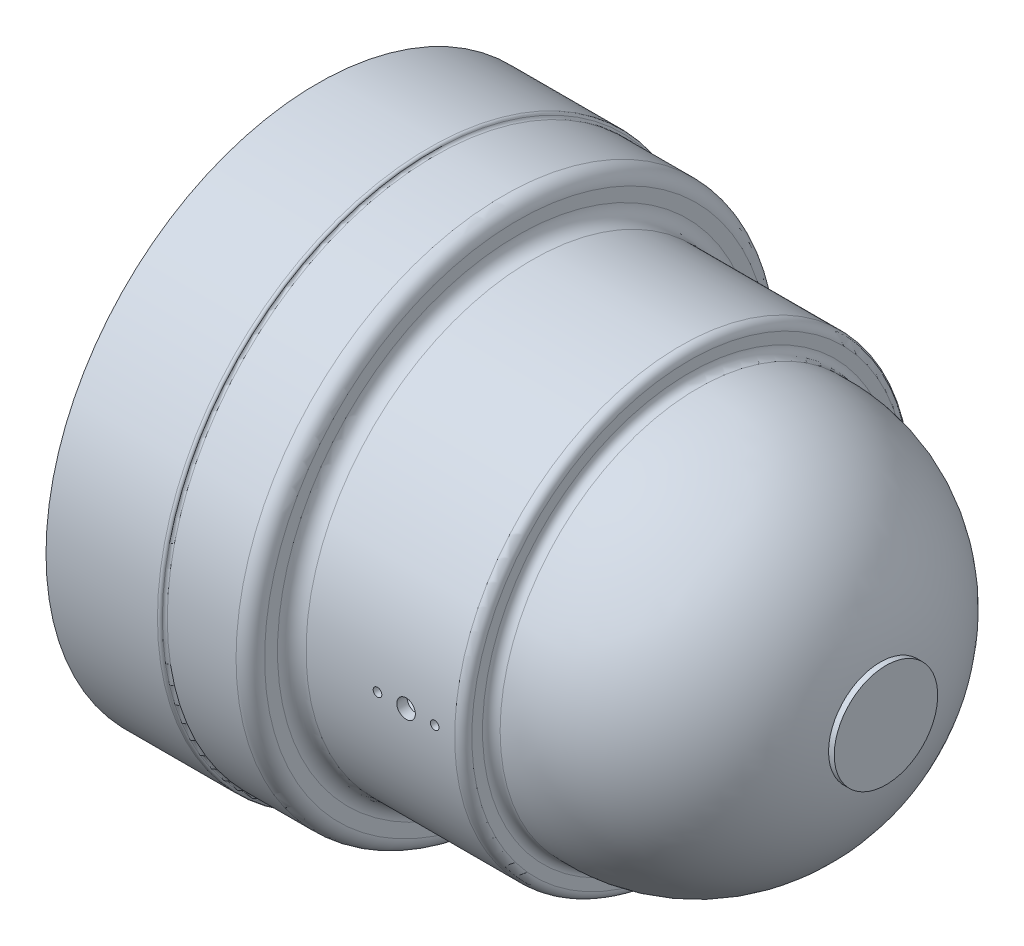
SolidWorks part; units mm, degrees
ref_plane "Plan de face" through (0, 0, 0) normal (0, 0, 1) x (1, 0, 0)
ref_plane "Plan de dessus" through (0, 0, 0) normal (0, 1, 0) x (1, 0, 0)
ref_plane "Plan de droite" through (0, 0, 0) normal (1, 0, 0) x (0, 0, -1)
sketch "Esquisse1" plane through (0, 0, 0) normal (0, 0, 1) x (1, 0, 0)
  line L0 (-213.0143, 0) -> (196.9793, 0) construction
  line L1 (-90, 93.5) -> (-90, 95)
  line L2 (0, 0) -> (-130, 0)
  line L4 (-130, 95) -> (-90, 95)
  line L5 (-130, 0) -> (-130, 95)
  line L6 (-60, 0) -> (-90, 0)
  line L7 (-60, 93.5) -> (-60, 79)
  line L8 (-60, 93.5) -> (-90, 93.5)
  line L9 (-90, 95) -> (-90, 0) construction
  line L10 (-60, 79) -> (0, 79)
  line L11 (0, 0) -> (66.93, 0)
  line L12 (-60, 0) -> (0, 0)
  line L13 (0, 79) -> (0, 0)
  line L14 (0, 0) -> (0, 18.1)
  line L15 (0, 18.1) -> (66.93, 18.1)
  line L16 (66.93, 0) -> (66.93, 18.1)
  line L17 (66.93, 18.1) -> (68.93, 18.1)
  line L18 (66.93, 18.1) -> (66.93, 0)
  line L19 (66.93, 0) -> (68.93, 0)
  line L20 (68.93, 18.1) -> (68.93, 0)
  arc A0 (0, 69) -> (66.93, 18.1) centre (6.4974, 8.0894) cw
  point P5 (0, 69)
  dimension "D12" = 2
  dimension "D11" = 61.2561
  dimension "D1" = 130
  dimension "D2" = 95
  dimension "D3" = 40
  dimension "D4" = 30
  dimension "D5" = 93.5
  dimension "D6" = 79
  dimension "D7" = 60
  dimension "D8" = 10
  dimension "D9" = 66.93
  dimension "D10" = 18.1
revolve "Révolution1" add sketch "Esquisse1" angle 360 about L0
shell "Coque1" thickness 3.6
fillet "Congé1" radius 1 1 edges at (-90, 0, 95)
fillet "Congé2" radius 1 1 edges at (-90, 0, 93.5)
fillet "Congé3" radius 5 1 edges at (-60, 0, 93.5)
fillet "Congé4" radius 5 1 edges at (-60, 0, 79)
fillet "Congé6" radius 3 2 edges at (0, 0, 79) (0, 0, 69)
sketch "Esquisse2" plane through (0, 0, 0) normal (0, 0, 1) x (1, 0, 0)
  line L0 (-130, 95) -> (-130, -95) construction
  line L1 (-130, 0) -> (0, 0) construction
  line L2 (-20, 0) -> (-130, 0) construction
  line L3 (-20, 20.4537) -> (-20, -28.489) construction
  circle A0 centre (-20, 0) radius 3.25
  circle A1 centre (-30, 0) radius 1.5
  circle A2 centre (-10, 0) radius 1.5
  dimension "D2" = 6.5
  dimension "D4" = 3
  dimension "D1" = 110
  dimension "D3" = 10
extrude "Enlèv. mat.-Extru.1" cut sketch "Esquisse2" along normal through all
